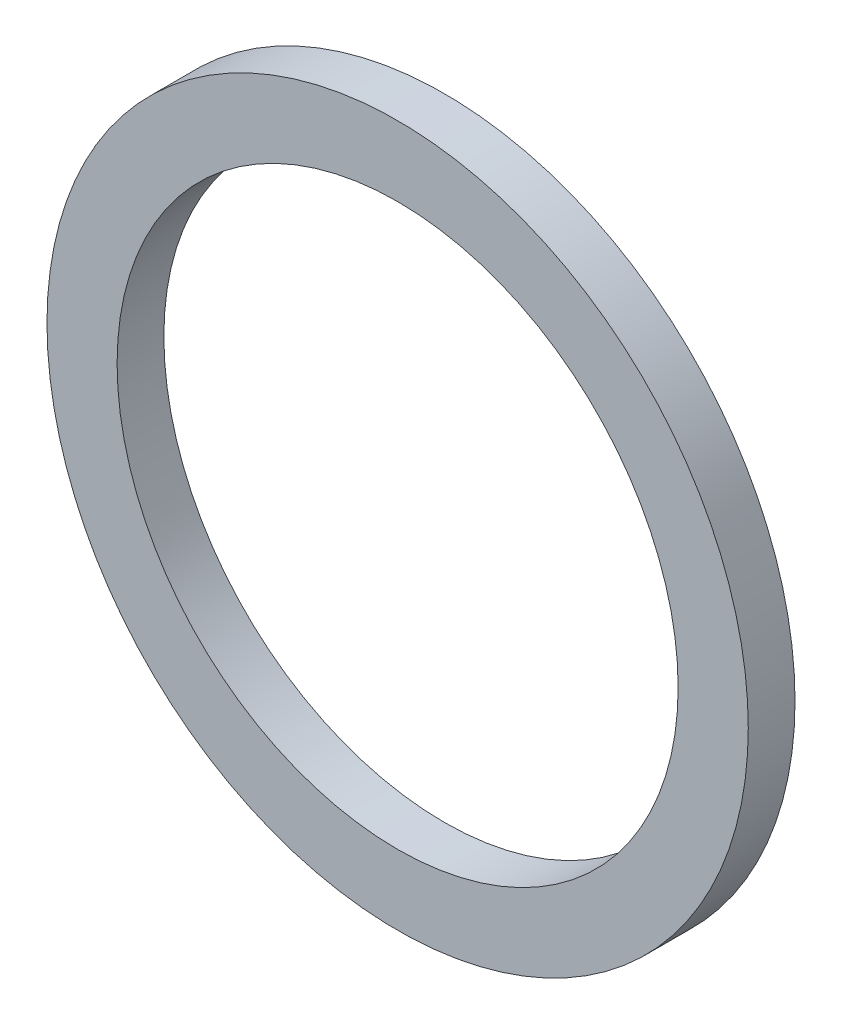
SolidWorks part; units mm, degrees
ref_plane "前视基准面" through (0, 0, 0) normal (0, 0, 1) x (1, 0, 0)
ref_plane "上视基准面" through (0, 0, 0) normal (0, 1, 0) x (1, 0, 0)
ref_plane "右视基准面" through (0, 0, 0) normal (1, 0, 0) x (0, 0, -1)
sketch "草图1" plane through (0, 0, 1) normal (0, 0, 1) x (1, 0, 0)
  circle A0 centre (0, 0) radius 6
  circle A1 centre (0, 0) radius 7.5
  dimension "D1" = 12
  dimension "D2" = 15
extrude "拉伸1" add sketch "草图1" along normal blind 1
